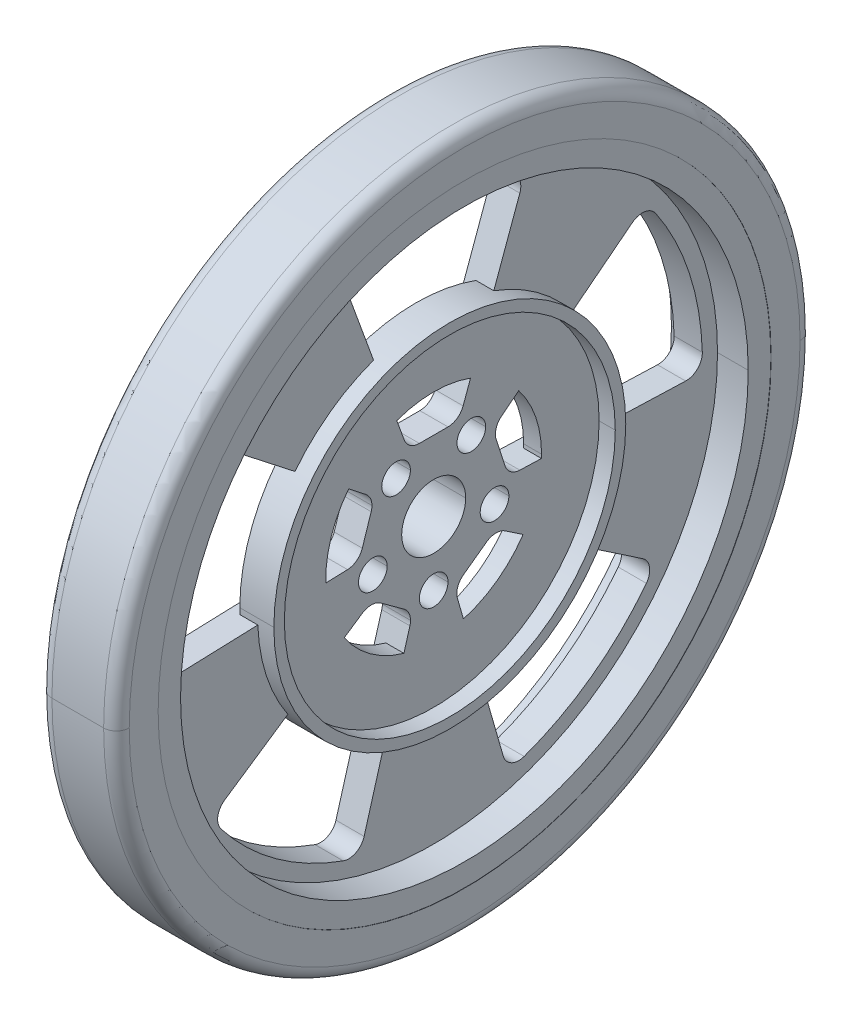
SolidWorks part; units mm, degrees
ref_plane "Front Plane" through (0, 0, 0) normal (0, 0, 1) x (1, 0, 0)
ref_plane "Top Plane" through (0, 0, 0) normal (0, 1, 0) x (1, 0, 0)
ref_plane "Right Plane" through (0, 0, 0) normal (1, 0, 0) x (0, 0, -1)
imported_body "Wheels.STEP<1>"
fillet "Fillet1" radius 1.27
